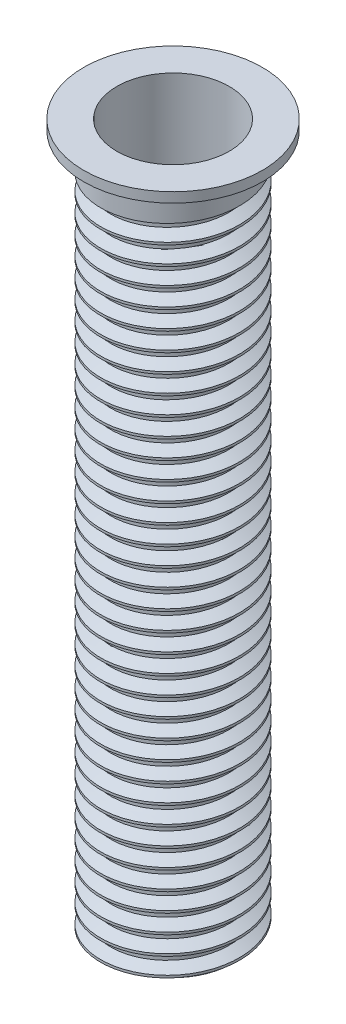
SolidWorks part; units mm, degrees
ref_plane "Front Plane" through (0, 0, 0) normal (0, 0, 1) x (1, 0, 0)
ref_plane "Top Plane" through (0, 0, 0) normal (0, 1, 0) x (1, 0, 0)
ref_plane "Right Plane" through (0, 0, 0) normal (1, 0, 0) x (0, 0, -1)
sketch "Sketch1" plane through (0, 0, 0) normal (0, 1, 0) x (1, 0, 0)
  circle A0 centre (0, 0) radius 10.5
  dimension "D1" = 21
extrude "Boss-Extrude1" add sketch "Sketch1" along normal blind 101.6
thread "Thread1" pitch 2.8222 start angle 0, offset 0, length 0, pitch 2.8222, diameter 21
ref_plane "Plane1" through (-10.5, 101.6, 0) normal (0, 0, 1) x (-1, 0, 0)
sketch "Thread Profile1" plane through (-10.5, 101.6, 0) normal (0, 0, 1) x (-1, 0, 0)
  line L0 (0, 0) -> (0, 2.8222) construction
  line L11 (0, 0) -> (0, 2.4694)
  line L12 (0, 2.4694) -> (-1.5276, 1.5875)
  line L13 (-1.5276, 1.5875) -> (-1.5276, 0.8819)
  line L15 (-1.5276, 0.8819) -> (0, 0)
  line L17 (-1.5276, 1.2347) -> (0, 1.2347) construction
  point P2 (0, 0)
  dimension "Pitch" = 2.8222
  dimension "Profile_Angle" = 60
  dimension "Profile_Land" = 0.7056
  dimension "Profile_Height" = 1.5276
sketch "Sketch7" plane through (0, 101.6, 0) normal (0, 1, 0) x (1, 0, 0)
  circle A0 centre (0, 0) radius 10.5
  dimension "D1" = 21
extrude "Boss-Extrude2" add sketch "Sketch7" along normal blind 3
sketch "Sketch8" plane through (0, 104.6, 0) normal (0, 1, 0) x (1, 0, 0)
  circle A0 centre (0, 0) radius 13.5
  dimension "D1" = 27
extrude "Boss-Extrude3" add sketch "Sketch8" along normal blind 1.5
sketch "Sketch9" plane through (0, 106.1, 0) normal (0, 1, 0) x (1, 0, 0)
  circle A0 centre (0, 0) radius 8.5
  dimension "D1" = 17
extrude "Cut-Extrude1" cut sketch "Sketch9" against normal through all
